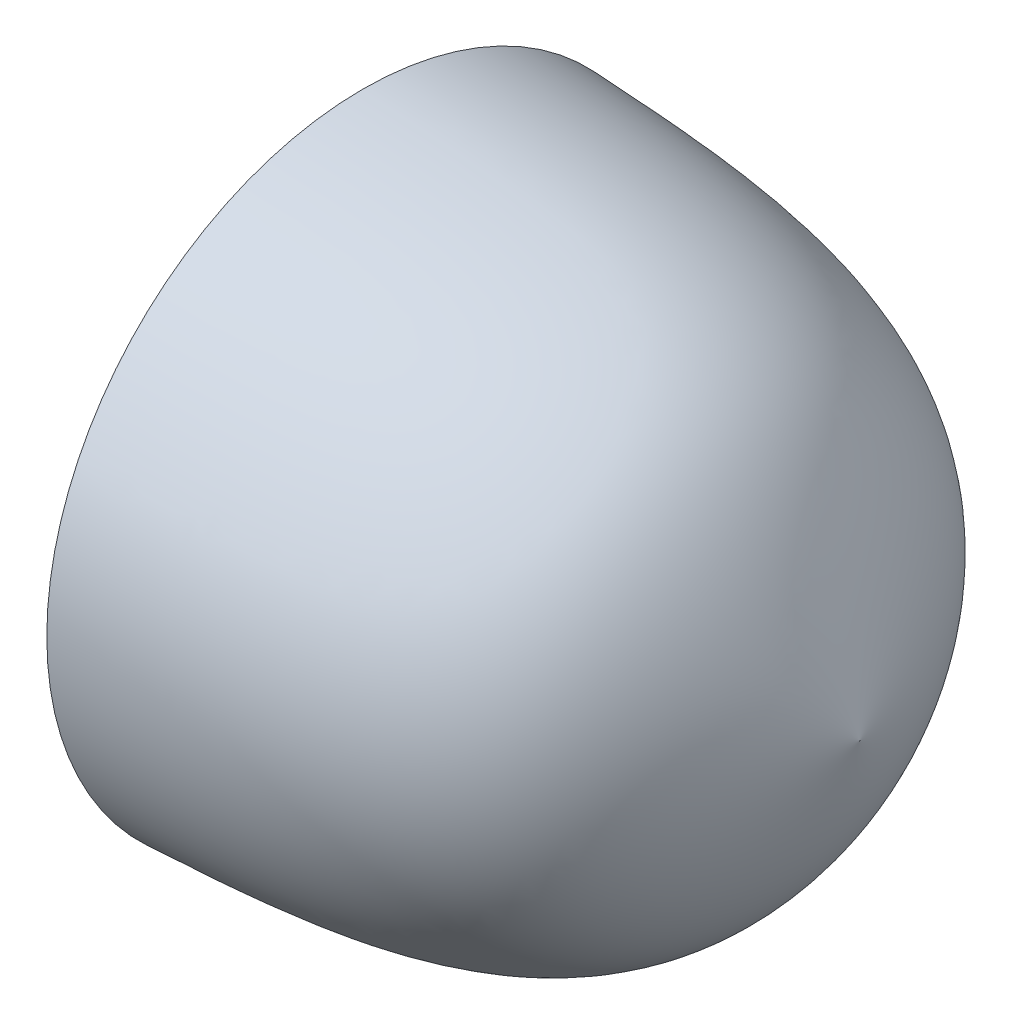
SolidWorks part; units mm, degrees
ref_plane "Plan de face" through (0, 0, 0) normal (0, 0, 1) x (1, 0, 0)
ref_plane "Plan de dessus" through (0, 0, 0) normal (0, 1, 0) x (1, 0, 0)
ref_plane "Plan de droite" through (0, 0, 0) normal (1, 0, 0) x (0, 0, -1)
sketch "Esquisse1" plane through (0, 0, 0) normal (0, 0, 1) x (1, 0, 0)
  line L0 (-52.3886, 0) -> (64.2651, 0) construction
  line L1 (-27.0521, 0) -> (-27.0521, 6)
  line L2 (-27.0521, 6) -> (-7.0521, 6)
  line L3 (-7.0521, 6) -> (-7.0521, 35)
  line L4 (-27.0521, 0) -> (47.9479, 0)
  point P7 (35.7403, 23.8954)
  dimension "D1" = 70
  dimension "D2" = 55
  dimension "D3" = 20
  dimension "D4" = 12
revolve "Révolution1" add sketch "Esquisse1" angle 360 about L0
